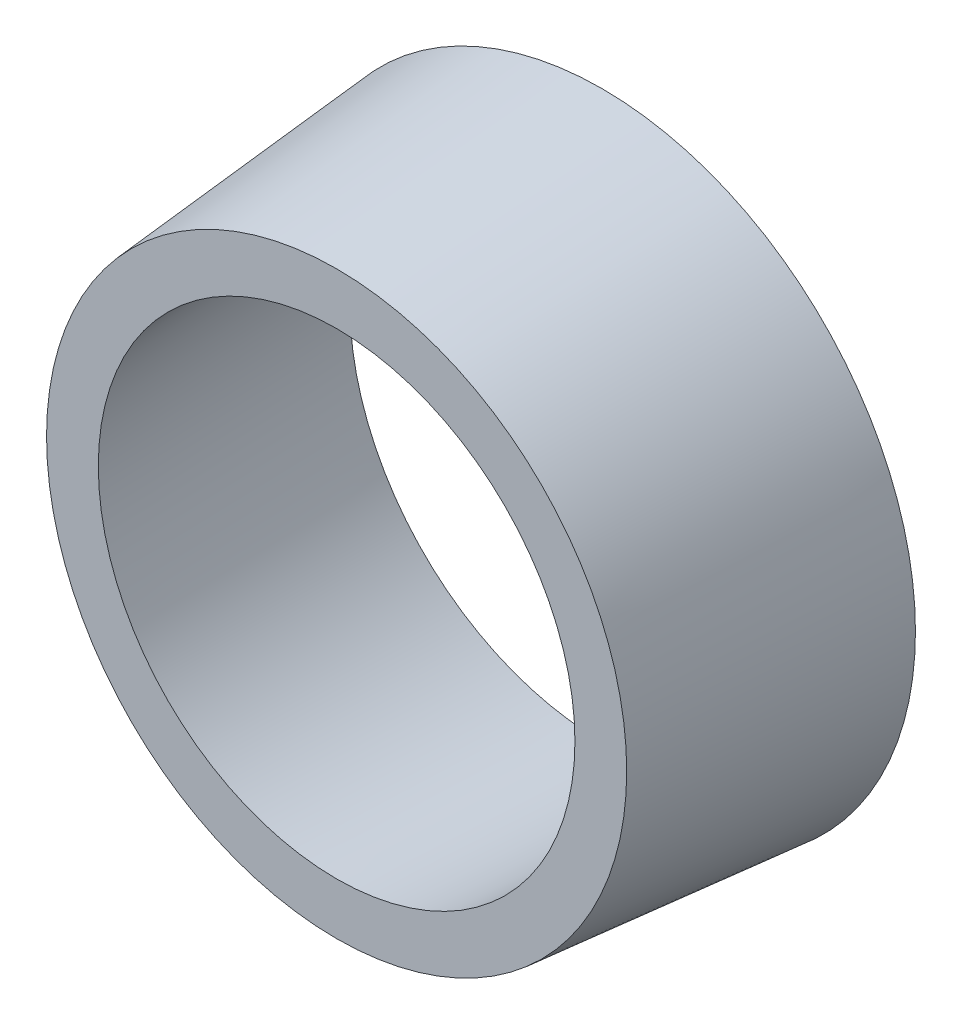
SolidWorks part; units mm, degrees
ref_plane "Plan de face" through (0, 0, 0) normal (0, 0, 1) x (1, 0, 0)
ref_plane "Plan de dessus" through (0, 0, 0) normal (0, 1, 0) x (1, 0, 0)
ref_plane "Plan de droite" through (0, 0, 0) normal (1, 0, 0) x (0, 0, -1)
sketch "Esquisse1" plane through (0, 0, 0) normal (0, 0, 1) x (1, 0, 0)
  circle A0 centre (0, 0) radius 5.9
  dimension "D1" = 11.8
extrude "Boss.-Extru.1" add sketch "Esquisse1" along normal blind 5 draft 5
sketch "Esquisse2" plane through (0, 0, 0) normal (0, 0, -1) x (-1, 0, 0)
  circle A0 centre (0, 0) radius 4.75
  dimension "D1" = 9.5
extrude "Enlèv. mat.-Extru.2" cut sketch "Esquisse2" against normal blind 10 draft 3
